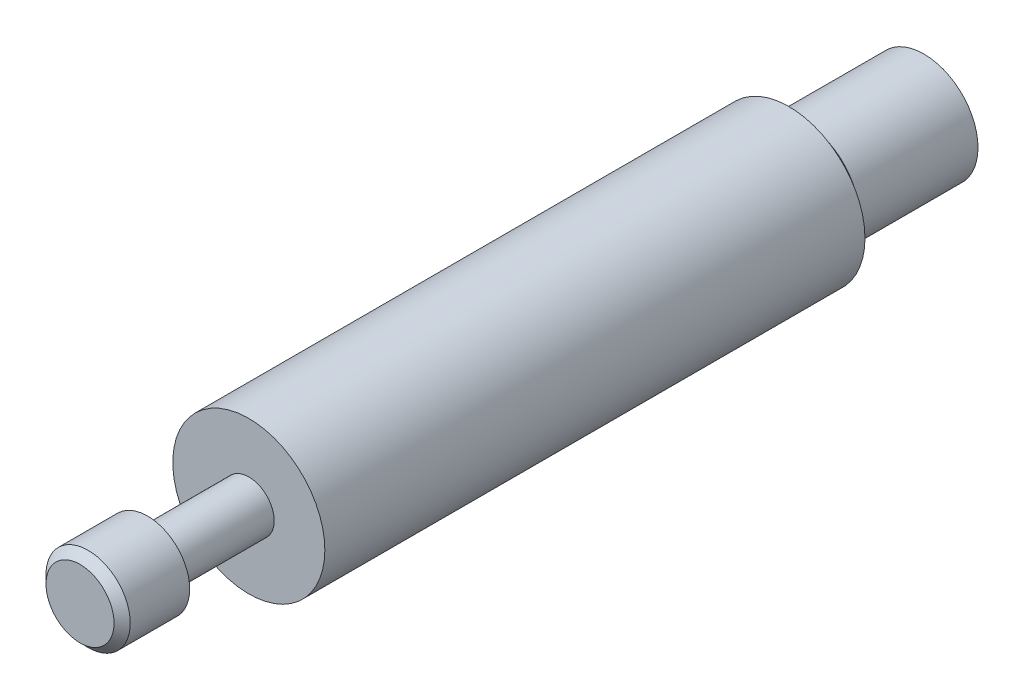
SolidWorks part; units mm, degrees
ref_plane "Front/Back" through (0, 0, 0) normal (0, 0, 1) x (1, 0, 0)
ref_plane "Top/Bottom" through (0, 0, 0) normal (0, 1, 0) x (1, 0, 0)
ref_plane "Right/Left" through (0, 0, 0) normal (1, 0, 0) x (0, 0, -1)
sketch "Sketch1" plane through (0, 0, 0) normal (0, 0, 1) x (1, 0, 0)
  circle A0 centre (0, 0) radius 7.1501
  dimension "D1" = 14.3002
extrude "Extrude1" add sketch "Sketch1" along normal mid plane 50.8
sketch "Sketch2" plane through (0, 0, -25.4) normal (0, 0, -1) x (-1, 0, 0)
  circle A0 centre (0, 0) radius 5.08
  dimension "D1" = 10.16
extrude "Extrude2" add sketch "Sketch2" along normal blind 12.7
chamfer "Chamfer1" distance 1.524 angle 45 1 edges at (5.08, 0, -25.4)
sketch "Sketch3" plane through (0, 0, 25.4) normal (0, 0, 1) x (1, 0, 0)
  circle A0 centre (0, 0) radius 2.3876
  dimension "D1" = 4.7752
extrude "Extrude3" add sketch "Sketch3" along normal blind 9.525
sketch "Sketch5" plane through (0, 0, 34.925) normal (0, 0, 1) x (1, 0, 0)
  circle A0 centre (0, 0) radius 3.9624
  dimension "D1" = 7.9248
extrude "Extrude4" add sketch "Sketch5" along normal blind 6.35
chamfer "Chamfer2" distance 0.762 angle 45 1 edges at (3.9624, 0, 41.275)
